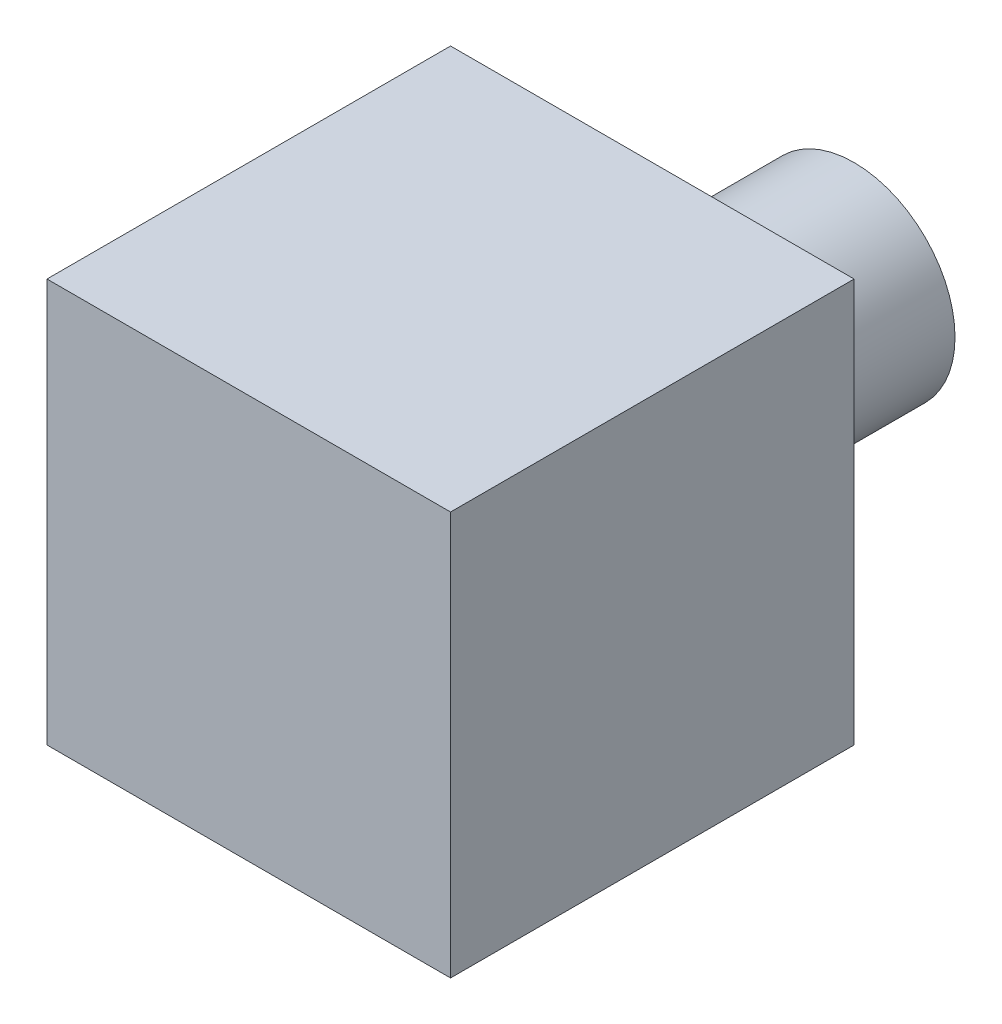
SolidWorks part; units mm, degrees
ref_plane "Plan de face" through (0, 0, 0) normal (0, 0, 1) x (1, 0, 0)
ref_plane "Plan de dessus" through (0, 0, 0) normal (0, 1, 0) x (1, 0, 0)
ref_plane "Plan de droite" through (0, 0, 0) normal (1, 0, 0) x (0, 0, -1)
sketch "Esquisse1" plane through (0, 0, 0) normal (0, 0, 1) x (1, 0, 0)
  line L1 (-10, 10) -> (10, 10)
  line L2 (-10, 10) -> (-10, -10)
  line L3 (-10, -10) -> (10, -10)
  line L4 (10, 10) -> (10, -10)
  dimension "D1" = 20
  dimension "D2" = 10
  dimension "D3" = 20
  dimension "D4" = 10
extrude "Boss.-Extru.1" add sketch "Esquisse1" along normal blind 20
sketch "Esquisse2" plane through (0, 0, 0) normal (0, 0, -1) x (-1, 0, 0)
  circle A0 centre (0, 0) radius 5
  dimension "D1" = 10
extrude "Boss.-Extru.2" add sketch "Esquisse2" along normal blind 10
